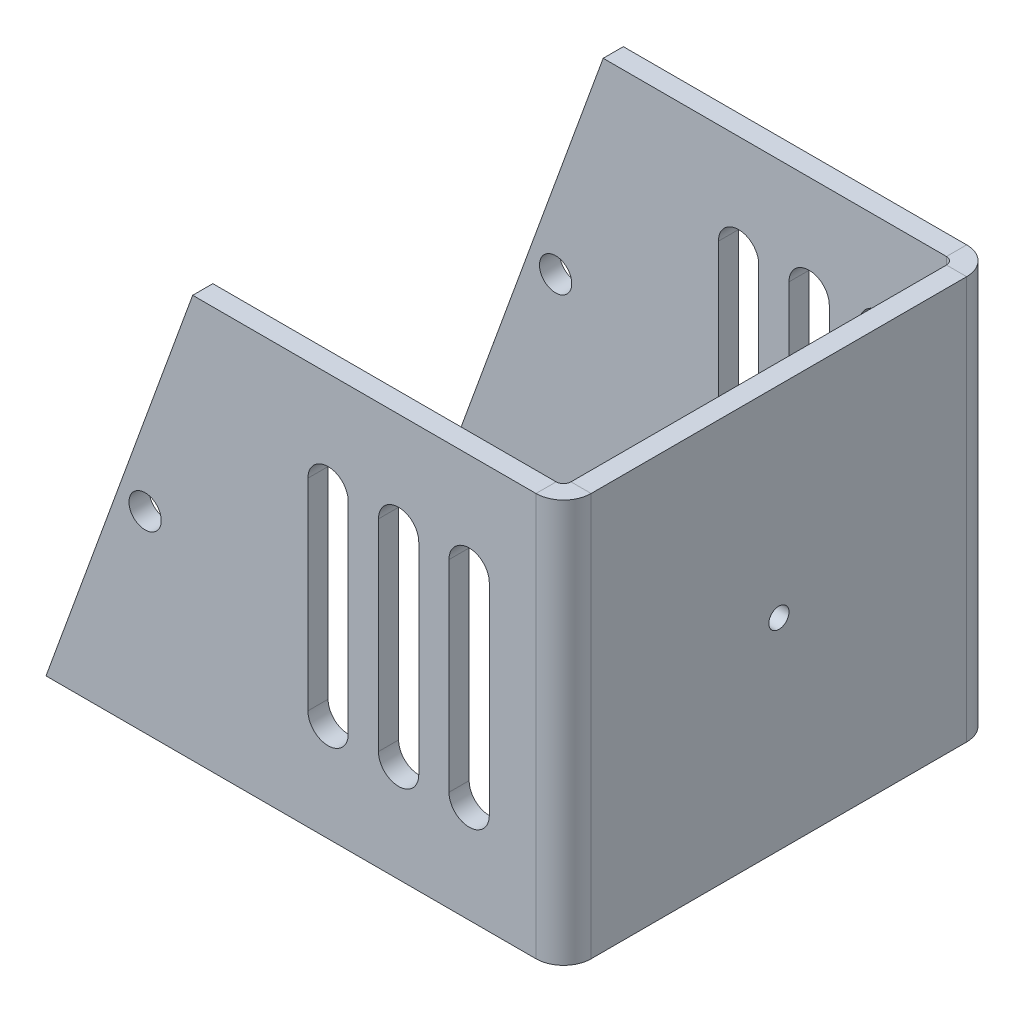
SolidWorks part; units mm, degrees
ref_plane "Plan de face" through (0, 0, 0) normal (0, 0, 1) x (1, 0, 0)
ref_plane "Plan de dessus" through (0, 0, 0) normal (0, 1, 0) x (1, 0, 0)
ref_plane "Plan de droite" through (0, 0, 0) normal (1, 0, 0) x (0, 0, -1)
sketch "Esquisse1" plane through (0, 0, 0) normal (0, 0, 1) x (1, 0, 0)
  line L0 (0, 0) -> (140, 0)
  line L1 (0, 0) -> (14.5589, 40.0002)
  line L2 (70, 15) -> (70, 25) construction
  line L3 (10.6723, 21.3658) -> (8.3584, 15.0086) construction
  line L4 (65, 20) -> (75, 20) construction
  line L5 (50, -5) -> (50, 45) construction
  line L6 (90, 45) -> (90, -5) construction
  line L7 (13.6024, 17.6987) -> (3.5273, 21.3658) construction
  line L8 (140, 0) -> (125.4411, 40.0002)
  line L11 (14.5589, 40.0002) -> (125.4411, 40.0002)
  circle A0 centre (9.8365, 19.0694) radius 1.6
  circle A1 centre (130.1635, 19.0694) radius 1.6
  circle A2 centre (70, 20) radius 1
extrude "Extrusion2" add sketch "Esquisse1" along normal blind 2
sketch "Esquisse2" plane through (0, 0, 2) normal (0, 0, 1) x (1, 0, 0)
  line L0 (50, 40.0002) -> (50, 0)
  line L1 (125.4411, 40.0002) -> (14.5589, 40.0002) construction
  line L2 (0, 0) -> (140, 0) construction
  line L3 (90, 40.0002) -> (90, 0)
sketch "Esquisse4" plane through (0, 0, 2) normal (0, 0, 1) x (1, 0, 0)
  line L0 (42, 35.8016) -> (42, 5.1646) construction
  line L1 (70, 16.757) -> (70, 53.7422) construction
  line L2 (5.4138, 30.0002) -> (63.7898, 30.0002) construction
  line L3 (125.4411, 40.0002) -> (14.5589, 40.0002) construction
  line L4 (-2.7284, 10) -> (67.9299, 10) construction
  line L5 (0, 0) -> (140, 0) construction
  line L6 (50, 50.7061) -> (50, -5.8758) construction
  line L7 (33, 30.0002) -> (33, 10)
  line L8 (40, 30.0002) -> (40, 10)
  line L9 (44, 30.0002) -> (44, 10)
  line L10 (37, 30.0002) -> (37, 10)
  line L11 (-9.7284, 10) -> (60.9299, 10) construction
  line L12 (-1.5862, 30.0002) -> (56.7898, 30.0002) construction
  line L13 (26, 30.0002) -> (26, 10)
  line L14 (30, 30.0002) -> (30, 10)
  line L15 (-16.7284, 10) -> (53.9299, 10) construction
  line L16 (-8.5862, 30.0002) -> (49.7898, 30.0002) construction
  line L17 (110, 30.0002) -> (110, 10)
  line L18 (114, 30.0002) -> (114, 10)
  line L19 (103, 30.0002) -> (103, 10)
  line L20 (96, 30.0002) -> (96, 10)
  line L21 (100, 30.0002) -> (100, 10)
  line L22 (107, 30.0002) -> (107, 10)
  arc A0 (40, 30.0002) -> (44, 30.0002) centre (42, 30.0002) cw
  arc A1 (44, 10) -> (40, 10) centre (42, 10) cw
  arc A2 (33, 30.0002) -> (37, 30.0002) centre (35, 30.0002) cw
  arc A3 (37, 10) -> (33, 10) centre (35, 10) cw
  arc A4 (26, 30.0002) -> (30, 30.0002) centre (28, 30.0002) cw
  arc A5 (30, 10) -> (26, 10) centre (28, 10) cw
  arc A6 (110, 10) -> (114, 10) centre (112, 10) ccw
  arc A7 (114, 30.0002) -> (110, 30.0002) centre (112, 30.0002) ccw
  arc A8 (103, 10) -> (107, 10) centre (105, 10) ccw
  arc A9 (107, 30.0002) -> (103, 30.0002) centre (105, 30.0002) ccw
  arc A10 (96, 10) -> (100, 10) centre (98, 10) ccw
  arc A11 (100, 30.0002) -> (96, 30.0002) centre (98, 30.0002) ccw
  dimension "D1" = 10
  dimension "D2" = 10
  dimension "D3" = 20
  dimension "D4" = 8
extrude "Enlèv. mat.-Extru.2" cut sketch "Esquisse4" against normal blind 10
sheet metal parameters "Tôlerie 1" parameters "D1"=0.7366
flatten bends "Dépliage 1" parameters "D1"=0
sketch "Esquisse-Angle1" plane through (0, 0, 2) normal (0, 0, 1) x (1, 0, 0)
process bends "Pliage 1" parameters "D1"=0.7366
sketch "Esquisse-Plate1" plane through (0, 0, 2) normal (0, 0, 1) x (1, 0, 0)
sketched bend "Pli esquissé1" parameters "D1"=0
bend "Pli esquissé2" bend radius 0.7366 bend angle 90 parameters "D5"=1
bend "Pli esquissé3" bend radius 0 bend angle 90 parameters "D5"=2
flat pattern "Etat déplié1"
sketch "Lignes de pliage1" plane through (0, 0, 2) normal (0, 0, 1) x (1, 0, 0)
  line L0 (90, 40.0002) -> (90, 0) construction
  line L1 (50, 40.0002) -> (50, 0) construction
bend of the flat pattern "Dépliage-<Pli esquissé2>1"
bend of the flat pattern "Dépliage-<Pli esquissé3>1"
